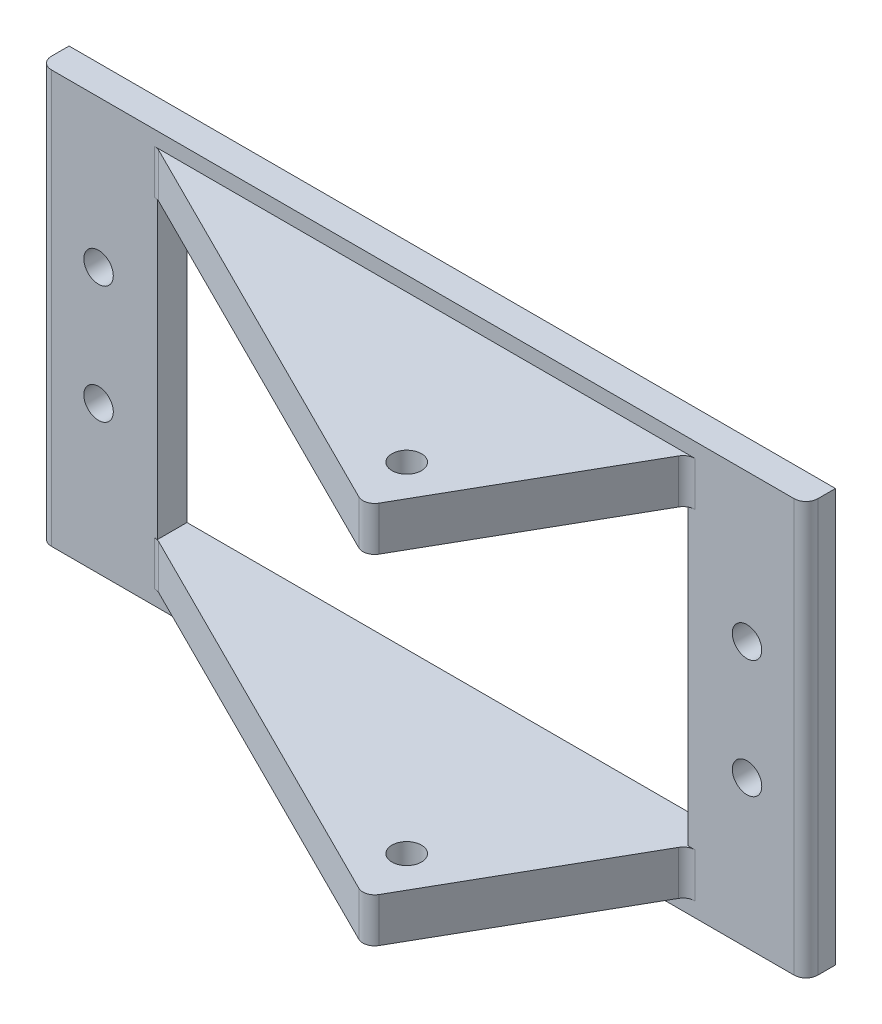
SolidWorks part; units mm, degrees
ref_plane "Front Plane" through (0, 0, 0) normal (0, 0, 1) x (1, 0, 0)
ref_plane "Top Plane" through (0, 0, 0) normal (0, 1, 0) x (1, 0, 0)
ref_plane "Right Plane" through (0, 0, 0) normal (1, 0, 0) x (0, 0, -1)
sketch "Sketch1" plane through (0, 0, 0) normal (0, 0, 1) x (1, 0, 0)
  line L1 (-82.55, 44.45) -> (82.55, 44.45)
  line L2 (-82.55, 44.45) -> (-82.55, -44.45)
  line L3 (-82.55, -44.45) -> (82.55, -44.45)
  line L4 (82.55, 44.45) -> (82.55, -44.45)
  line L5 (-82.55, 44.45) -> (82.55, -44.45) construction
  line L6 (-82.55, -44.45) -> (82.55, 44.45) construction
  point P0 (0, 0)
  dimension "D1" = 165.1
  dimension "D2" = 88.9
extrude "Boss-Extrude1" add sketch "Sketch1" along normal blind 50.8
sketch "Sketch2" plane through (0, 0, 50.8) normal (0, 0, 1) x (1, 0, 0)
  line L0 (-82.55, 0) -> (82.55, 0) construction
  line L1 (82.55, -44.45) -> (82.55, 44.45) construction
  line L2 (0, 0) -> (0, -31.75) construction
  line L3 (-57.15, 31.75) -> (57.15, 31.75)
  line L4 (-57.15, 31.75) -> (-57.15, -31.75)
  line L5 (-57.15, -31.75) -> (57.15, -31.75)
  line L6 (57.15, 31.75) -> (57.15, -31.75)
  line L7 (-57.15, 31.75) -> (57.15, -31.75) construction
  line L8 (-57.15, -31.75) -> (57.15, 31.75) construction
  circle A0 centre (-69.85, 12.7) radius 3.175
  circle A1 centre (-69.85, -12.7) radius 3.175
  circle A2 centre (69.85, -12.7) radius 3.175
  circle A3 centre (69.85, 12.7) radius 3.175
  point P0 (0, 0)
  point P6 (0, 0)
  dimension "D3" = 6.35
  dimension "D1" = 114.3
  dimension "D2" = 63.5
  dimension "D4" = 12.7
  dimension "D5" = 12.7
extrude "Cut-Extrude1" cut sketch "Sketch2" against normal through all
ref_plane "Plane1" through (0, -40.64, 0) normal (0, -1, 0) x (-1, 0, 0)
ref_plane "Plane2" through (0, 1.905, 0) normal (0, -1, 0) x (-1, 0, 0)
ref_plane "Plane3" through (0, 40.64, 0) normal (0, 1, 0) x (1, 0, 0)
sketch "Sketch3" plane through (0, 0, 0) normal (0, 0, -1) x (-1, 0, 0)
  line L1 (-57.15, 38.1) -> (57.15, 38.1)
  line L2 (-57.15, 38.1) -> (-57.15, -38.1)
  line L3 (-57.15, -38.1) -> (57.15, -38.1)
  line L4 (57.15, 38.1) -> (57.15, -38.1)
  line L5 (-57.15, 38.1) -> (57.15, -38.1) construction
  line L6 (-57.15, -38.1) -> (57.15, 38.1) construction
  point P0 (0, 0)
  dimension "D1" = 76.2
sketch "Sketch4" plane through (0, 0, 50.8) normal (0, 0, 1) x (1, 0, 0)
  line L1 (82.55, 44.45) -> (-82.55, 44.45)
  line L2 (82.55, 44.45) -> (82.55, -44.45)
  line L3 (82.55, -44.45) -> (-82.55, -44.45)
  line L4 (-82.55, 44.45) -> (-82.55, -44.45)
  line L5 (82.55, 44.45) -> (-82.55, -44.45) construction
  line L6 (82.55, -44.45) -> (-82.55, 44.45) construction
  line L7 (57.15, 41.275) -> (-57.15, 41.275)
  line L8 (57.15, 41.275) -> (57.15, -41.275)
  line L9 (57.15, -41.275) -> (-57.15, -41.275)
  line L10 (-57.15, 41.275) -> (-57.15, -41.275)
  line L11 (57.15, 41.275) -> (-57.15, -41.275) construction
  line L12 (57.15, -41.275) -> (-57.15, 41.275) construction
  point P0 (0, 0)
  point P7 (0, 0)
  dimension "D1" = 82.55
  dimension "D2" = 114.3
extrude "Cut-Extrude2" cut sketch "Sketch4" against normal blind 44.45
sketch "Sketch5" plane through (0, -41.275, 0) normal (0, -1, 0) x (1, 0, 0)
  line L0 (0, 0) -> (31.75, 0) construction
  line L1 (-82.55, 0) -> (82.55, 0) construction
  line L2 (31.75, 35.4766) -> (31.75, 50.8) construction
  line L3 (31.75, 0) -> (31.75, 6.35) construction
  line L4 (-57.15, 50.8) -> (57.15, 50.8) construction
  line L6 (-57.15, 0) -> (31.75, 0) construction
  line L7 (57.15, 6.35) -> (31.75, 50.8)
  line L8 (31.75, 50.8) -> (-57.15, 6.35)
  line L12 (27.1461, 33.9189) -> (31.75, 50.8) construction
  line L13 (57.15, 6.35) -> (57.15, 50.8)
  line L14 (57.15, 50.8) -> (-57.15, 50.8)
  line L15 (-57.15, 50.8) -> (-57.15, 6.35)
  circle A0 centre (28.2864, 38.1) radius 3.175
  dimension "D6" = 6.35
  dimension "D1" = 31.75
  dimension "D2" = 88.9
  dimension "D3" = 45
  dimension "D4" = 12.7
extrude "Cut-Extrude4" cut sketch "Sketch5" against normal through all contours L8 M7 M8 | L7 M10 M7 | A0
fillet "Fillet2" radius 2.54 8 edges at (82.55, 0, 6.35) (57.15, 36.5125, 6.35) (57.15, -36.5125, 6.35) (31.75, -36.5125, 50.8) (31.75, 36.5125, 50.8) (-57.15, -36.5125, 6.35) (-57.15, 36.5125, 6.35) (-82.55, 0, 6.35)
